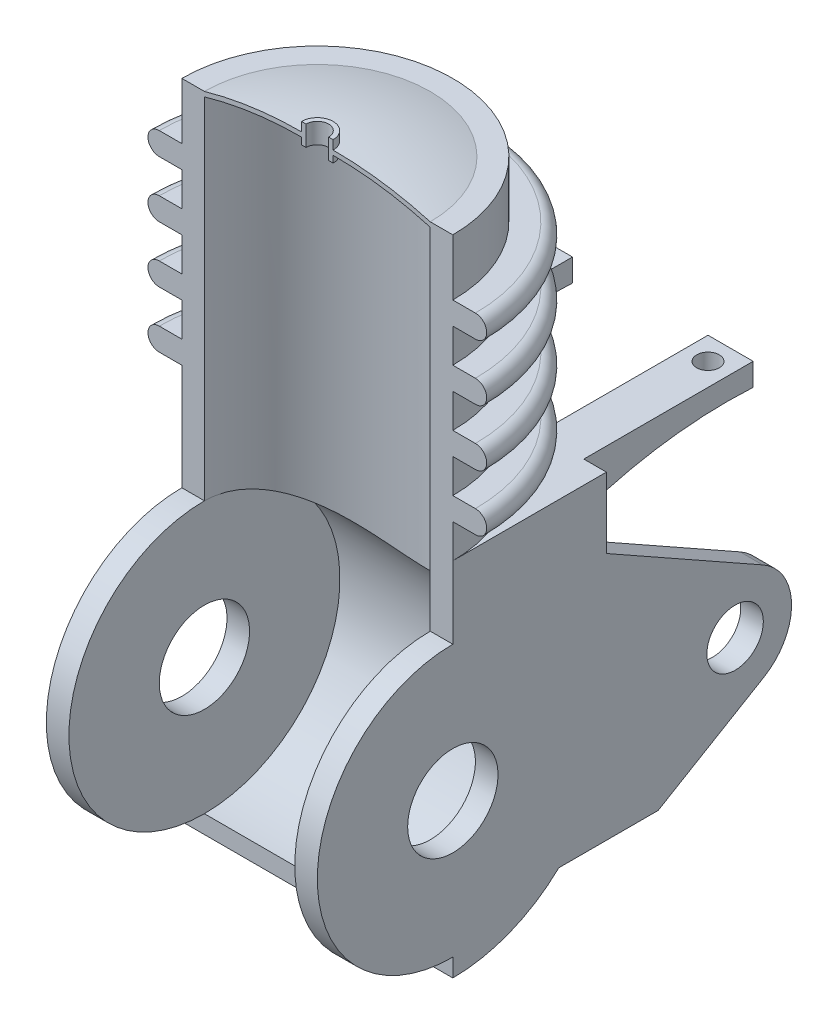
SolidWorks part; units mm, degrees
ref_plane "Front Plane" through (0, 0, 0) normal (0, 0, 1) x (1, 0, 0)
ref_plane "Top Plane" through (0, 0, 0) normal (0, 1, 0) x (1, 0, 0)
ref_plane "Right Plane" through (0, 0, 0) normal (1, 0, 0) x (0, 0, -1)
sketch "Sketch1" plane through (0, 0, 0) normal (1, 0, 0) x (0, 0, -1)
  line L0 (0, 0) -> (0, 160)
  line L1 (0, 160) -> (68, 160)
  line L2 (68, 160) -> (68, 68)
  arc A0 (68, 68) -> (0, 0) centre (0, 68) cw
  dimension "D1" = 160
  dimension "D2" = 68
extrude "Boss-Extrude1" add sketch "Sketch1" along normal mid plane 120
sketch "Sketch2" plane through (0, 0, 0) normal (0, 0, 1) x (1, 0, 0)
  line L0 (50, 160) -> (50, 282.9194)
  line L1 (60, 160) -> (-60, 160) construction
  line L2 (60, 160) -> (60, 175)
  line L3 (60, 175) -> (70, 175)
  line L4 (70, 185) -> (60, 185)
  line L5 (60, 185) -> (60, 200)
  line L6 (60, 200) -> (70, 200)
  line L7 (70, 210) -> (60, 210)
  line L8 (60, 210) -> (60, 225)
  line L9 (60, 225) -> (70, 225)
  line L10 (70, 235) -> (60, 235)
  line L11 (60, 235) -> (60, 250)
  line L12 (60, 250) -> (70, 250)
  line L13 (50, 160) -> (60, 160)
  line L14 (70, 260) -> (60, 260)
  line L15 (60, 260) -> (60, 285)
  line L16 (60, 285) -> (50, 285)
  line L17 (0, 0) -> (0, 298.11) construction
  line L18 (7, 291) -> (7, 295)
  line L19 (7, 295) -> (5, 295)
  line L20 (5, 295) -> (5, 286)
  line L21 (5, 286) -> (7, 286)
  line L22 (7, 286) -> (7, 289)
  arc A0 (70, 185) -> (70, 175) centre (70, 180) cw
  arc A1 (70, 200) -> (70, 210) centre (70, 205) ccw
  arc A2 (70, 225) -> (70, 235) centre (70, 230) ccw
  arc A3 (70, 250) -> (70, 260) centre (70, 255) ccw
  arc A4 (50, 285) -> (7, 291) centre (7.0116, 134) ccw
  arc A5 (7, 289) -> (50, 282.9194) centre (7.0116, 134) cw
  dimension "D3" = 5
  dimension "D11" = 155
  dimension "D12" = 157
  dimension "D1" = 10
  dimension "D2" = 20
  dimension "D4" = 10
  dimension "D5" = 125
  dimension "D6" = 10
  dimension "D7" = 10
  dimension "D8" = 14
  dimension "D9" = 3
  dimension "D10" = 135
  dimension "D13" = 9
revolve "Revolve1" add sketch "Sketch2" angle 180 about L17
sketch "Sketch3" plane through (60, 0, 0) normal (1, 0, 0) x (0, 0, -1)
  line L0 (0, 160) -> (0, 0) construction
  circle A0 centre (0, 68) radius 60
  arc A1 (0, 0) -> (68, 68) centre (0, 68) ccw construction
  dimension "D1" = 120
extrude "Cut-Extrude1" cut sketch "Sketch3" against normal through all
sketch "Sketch4" plane through (0, 160, 0) normal (0, 1, 0) x (1, 0, 0)
  line L0 (50, 0) -> (-50, 0) construction
  circle A0 centre (0, 0) radius 50
  arc A1 (50, 0) -> (-50, 0) centre (0, 0) ccw construction
extrude "Cut-Extrude2" cut sketch "Sketch4" against normal up to next
sketch "Sketch5" plane through (0, 0, 0) normal (0, 0, 1) x (1, 0, 0)
  line L0 (50, 282.9194) -> (50, 128) construction
  line L1 (60, 128) -> (50, 128)
  line L2 (60, 128) -> (60, 88)
  line L3 (60, 88) -> (50, 88)
  line L4 (50, 128) -> (50, 88)
  line L5 (-74.4349, 68) -> (91.6719, 68) construction
  line L7 (60, 8) -> (-60, 8) construction
  dimension "D1" = 20
  dimension "D2" = 60
revolve "Revolve2" add sketch "Sketch5" angle 360 about L5
mirror "Mirror1" about plane through (0, 0, 0) normal (1, 0, 0) of "Revolve2"
sketch "Sketch6" plane through (60, 0, 0) normal (1, 0, 0) x (0, 0, -1)
  line L0 (68, 68) -> (68, 160) construction
  line L1 (68, 68) -> (68, 128.7906)
  line L2 (68, 128.7906) -> (137.2671, 89.7834)
  line L3 (137.7314, 46.4846) -> (90.9301, 18.7906)
  line L4 (90.9301, 18.7906) -> (46.9301, 18.7906)
  line L5 (0, 68) -> (191.2924, 68) construction
  arc A0 (0, 0) -> (68, 68) centre (0, 68) ccw construction
  arc A1 (46.9301, 18.7906) -> (68, 68) centre (0, 68) ccw
  arc A2 (137.2671, 89.7834) -> (137.7314, 46.4846) centre (125, 68) cw
  circle A3 centre (125, 68) radius 12.5
  dimension "D1" = 25
  dimension "D5" = 25
  dimension "D2" = 60
  dimension "D3" = 125
  dimension "D4" = 110
  dimension "D6" = 44
extrude "Boss-Extrude2" add sketch "Sketch6" against normal blind 10
mirror "Mirror2" about plane through (0, 0, 0) normal (1, 0, 0) of "Boss-Extrude2"
ref_plane "Plane1" through (50, 0, 0) normal (1, 0, 0) x (0, 0, -1)
sketch "Sketch7" plane through (50, 0, 0) normal (1, 0, 0) x (0, 0, -1)
  line L0 (68, 160) -> (143, 160)
  line L1 (143, 160) -> (143, 150)
  line L3 (68, 160) -> (68, 140)
  line L4 (68, 128.7906) -> (68, 160) construction
  arc A0 (143, 150) -> (68, 140) centre (131.4555, -49.6665) ccw
  dimension "D4" = 200
  dimension "D1" = 75
  dimension "D2" = 10
  dimension "D3" = 20
extrude "Boss-Extrude3" add sketch "Sketch7" against normal blind 20
mirror "Mirror3" about plane through (0, 0, 0) normal (1, 0, 0) of "Boss-Extrude3"
sketch "Sketch8" plane through (0, 160, 0) normal (0, 1, 0) x (1, 0, 0)
  line L0 (-30, 143) -> (-50, 143) construction
  line L1 (-30, 143) -> (-30, 68) construction
  line L2 (30, 143) -> (30, 68) construction
  circle A0 centre (-40, 133) radius 5
  circle A1 centre (40, 133) radius 5
  dimension "D1" = 10
  dimension "D2" = 10
  dimension "D3" = 10
  dimension "D4" = 10
extrude "Cut-Extrude3" cut sketch "Sketch8" against normal up to next
